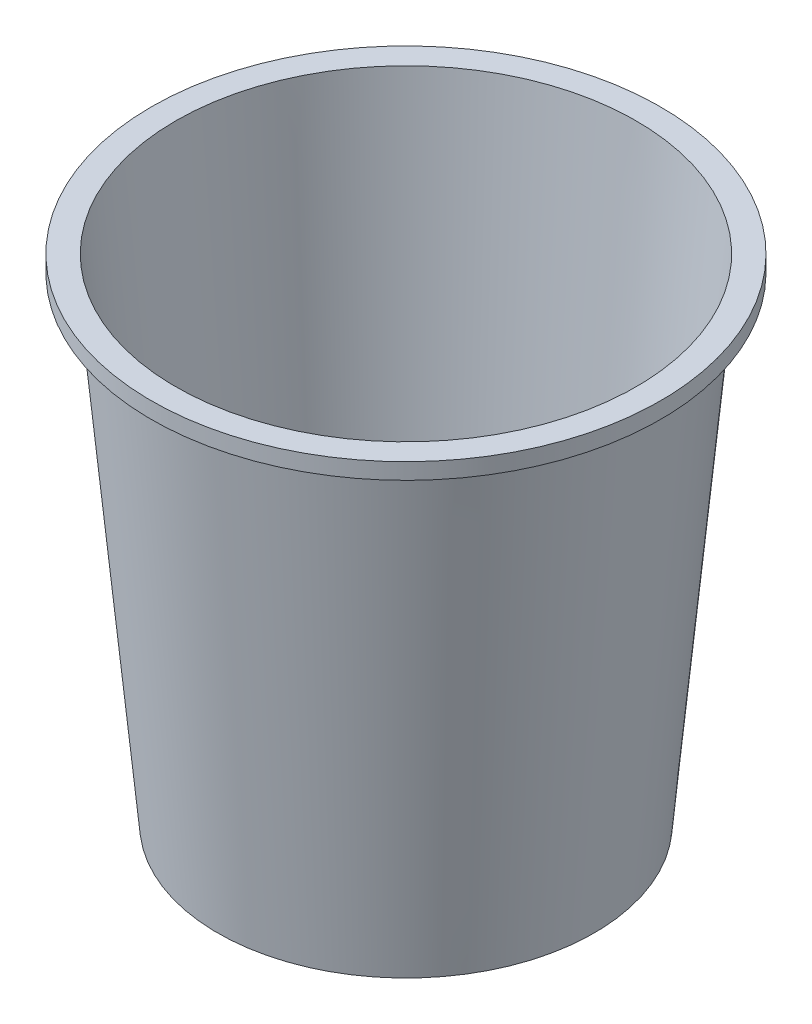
SolidWorks part; units mm, degrees
ref_plane "Front Plane" through (0, 0, 0) normal (0, 0, 1) x (1, 0, 0)
ref_plane "Top Plane" through (0, 0, 0) normal (0, 1, 0) x (1, 0, 0)
ref_plane "Right Plane" through (0, 0, 0) normal (1, 0, 0) x (0, 0, -1)
sketch "Sketch1" plane through (0, 0, 0) normal (0, 0, 1) x (1, 0, 0)
  line L0 (0, 0) -> (0, -89.0937) construction
  line L1 (0, -64.208) -> (22.7118, -64.208)
  line L2 (28.75, -10.208) -> (23.25, -69.208)
  line L3 (23.25, -69.208) -> (22.2457, -69.208)
  line L5 (28.4343, -8.208) -> (23.2605, -63.708)
  line L7 (29.1528, -0.5) -> (22.7944, -68.708) construction
  line L8 (27.5, 22.5034) -> (27.5, -73.149) construction
  line L9 (0, 0) -> (29.7016, 0) construction
  line L10 (0, -0.5) -> (29.1528, -0.5) construction
  line L11 (-44.3412, -23.6171) -> (71.703, -23.6171) construction
  line L12 (0, -63.708) -> (23.2605, -63.708)
  line L13 (28.4343, -8.208) -> (31.4343, -8.208)
  line L14 (29.7016, 0) -> (23.25, -69.208) construction
  line L15 (28.75, -10.208) -> (31.4343, -10.208)
  line L16 (31.4343, -8.208) -> (31.4343, -10.208)
  line L17 (0, -64.208) -> (0, -63.708)
  line L19 (22.7944, -68.708) -> (0, -68.708) construction
  line L20 (22.7118, -64.208) -> (22.2457, -69.208)
  line L22 (23.25, -69.208) -> (0, -69.208) construction
  point P19 (27.5, -23.6171)
  dimension "D1" = 61
  dimension "D2" = 27.5
  dimension "D3" = 46.5
  dimension "D5" = 5
  dimension "D6" = 3
  dimension "D7" = 2
  dimension "D8" = 57.5
  dimension "D9" = 0.5
  dimension "D10" = 45.5909
  dimension "D4" = 0.5
revolve "Revolve1" add sketch "Sketch1" angle 360 about L0
